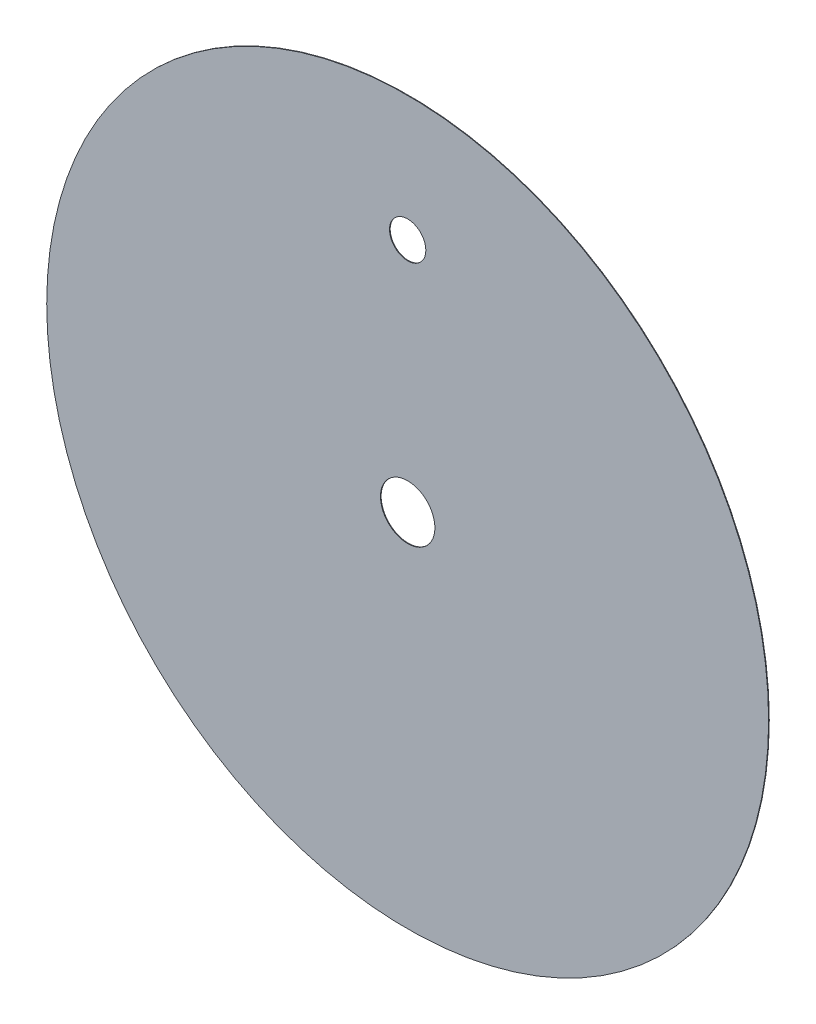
SolidWorks part; units mm, degrees
ref_plane "Face" through (0, 0, 0) normal (0, 0, 1) x (1, 0, 0)
ref_plane "Dessus" through (0, 0, 0) normal (0, 1, 0) x (1, 0, 0)
ref_plane "Droite" through (0, 0, 0) normal (1, 0, 0) x (0, 0, -1)
sketch "Esquisse1" plane through (0, 0, 0) normal (0, 0, 1) x (1, 0, 0)
  circle A0 centre (0, 0) radius 99.5
  circle A1 centre (0, 0) radius 7.5
  circle A2 centre (0, 0) radius 65 construction
  circle A3 centre (0, 65) radius 5
  circle A4 centre (0, -65) radius 5 construction
  dimension "D1" = 199
  dimension "D2" = 15
  dimension "D3" = 10
  dimension "D4" = 10
  dimension "D5" = 130
extrude "Extrusion1" add sketch "Esquisse1" along normal blind 0.175
